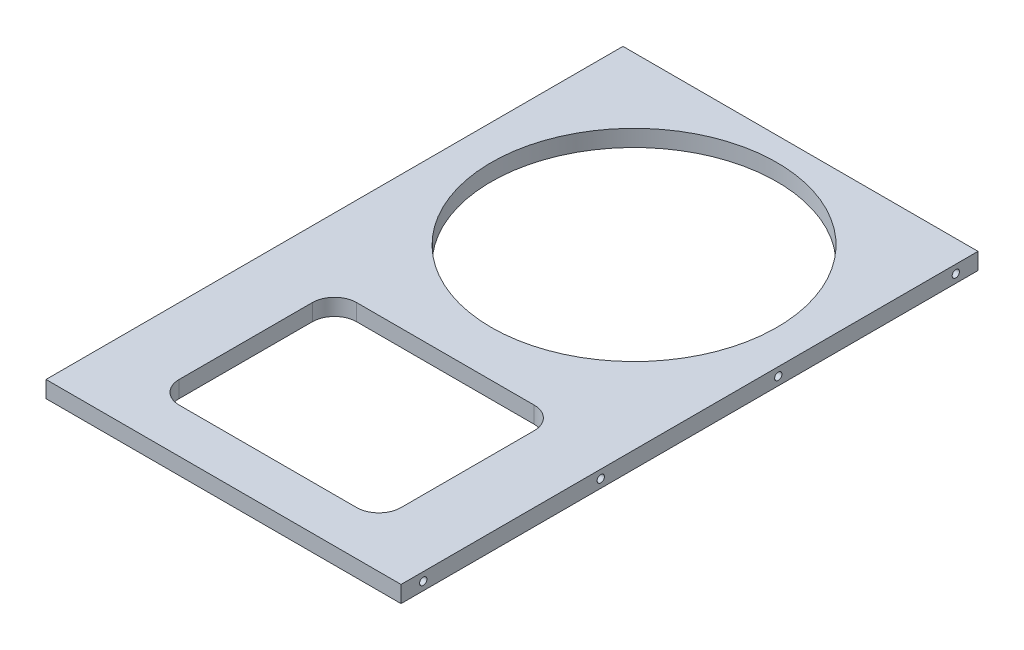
SolidWorks part; units mm, degrees
ref_plane "Front Plane" through (0, 0, 0) normal (0, 0, 1) x (1, 0, 0)
ref_plane "Top Plane" through (0, 0, 0) normal (0, 1, 0) x (1, 0, 0)
ref_plane "Right Plane" through (0, 0, 0) normal (1, 0, 0) x (0, 0, -1)
sketch "Sketch1" plane through (0, 0, 0) normal (0, 1, 0) x (1, 0, 0)
  line L1 (0, 0) -> (203.2, 0)
  line L2 (0, 0) -> (0, 330.2)
  line L3 (0, 330.2) -> (203.2, 330.2)
  line L4 (203.2, 0) -> (203.2, 330.2)
  dimension "D1" = 203.2
  dimension "D2" = 330.2
extrude "Extrude1" add sketch "Sketch1" along normal blind 9.525
sketch "Sketch2" plane through (203.2, 0, 0) normal (1, 0, 0) x (0, 0, -1)
  line L0 (0, 4.7625) -> (357.839, 4.7625) construction
  line L1 (0, 9.525) -> (0, 0) construction
  circle A0 centre (12.7, 4.7625) radius 2.0828
  circle A1 centre (114.3, 4.7625) radius 2.0828
  circle A2 centre (215.9, 4.7625) radius 2.0828
  circle A3 centre (317.5, 4.7625) radius 2.0828
  dimension "D1" = 101.6
  dimension "D2" = 101.6
  dimension "D3" = 101.6
  dimension "D5" = 4.1656
  dimension "D6" = 4.1656
  dimension "D7" = 4.1656
  dimension "D8" = 4.1656
  dimension "D4" = 12.7
extrude "Extrude2" cut sketch "Sketch2" against normal blind 19.05
sketch "Sketch3" plane through (0, 0, 0) normal (-1, 0, 0) x (0, 0, 1)
  circle A0 centre (-12.7, 4.7625) radius 2.0828 construction
  circle A1 centre (-114.3, 4.7625) radius 2.0828 construction
  circle A2 centre (-215.9, 4.7625) radius 2.0828 construction
  circle A3 centre (-317.5, 4.7625) radius 2.0828 construction
  circle A4 centre (-12.7, 4.7625) radius 2.0828
  circle A5 centre (-114.3, 4.7625) radius 2.0828
  circle A6 centre (-215.9, 4.7625) radius 2.0828
  circle A7 centre (-317.5, 4.7625) radius 2.0828
extrude "Extrude3" cut sketch "Sketch3" against normal blind 19.05
sketch "Sketch4" plane through (0, 9.525, 0) normal (0, 1, 0) x (1, 0, 0)
  circle A0 centre (101.6, 234.95) radius 81.7563
  dimension "D1" = 163.5125
extrude "Cut-Extrude1" cut sketch "Sketch4" against normal through all
sketch "Sketch5" plane through (0, 9.525, 0) normal (0, 1, 0) x (1, 0, 0)
  line L0 (0, 336.55) -> (0, -6.35) construction
  line L1 (50.8, 127) -> (152.4, 127)
  line L2 (38.1, 114.3) -> (38.1, 38.1)
  line L3 (50.8, 25.4) -> (152.4, 25.4)
  line L4 (165.1, 114.3) -> (165.1, 38.1)
  line L5 (203.2, 336.55) -> (203.2, -6.35) construction
  line L6 (0, 0) -> (203.2, 0) construction
  arc A0 (50.8, 127) -> (38.1, 114.3) centre (50.8, 114.3) ccw
  arc A1 (165.1, 114.3) -> (152.4, 127) centre (152.4, 114.3) ccw
  arc A2 (152.4, 25.4) -> (165.1, 38.1) centre (152.4, 38.1) ccw
  arc A3 (38.1, 38.1) -> (50.8, 25.4) centre (50.8, 38.1) ccw
  dimension "D1" = 12.7
  dimension "D2" = 38.1
  dimension "D3" = 38.1
  dimension "D4" = 25.4
  dimension "D5" = 101.6
extrude "Cut-Extrude2" cut sketch "Sketch5" against normal through all
